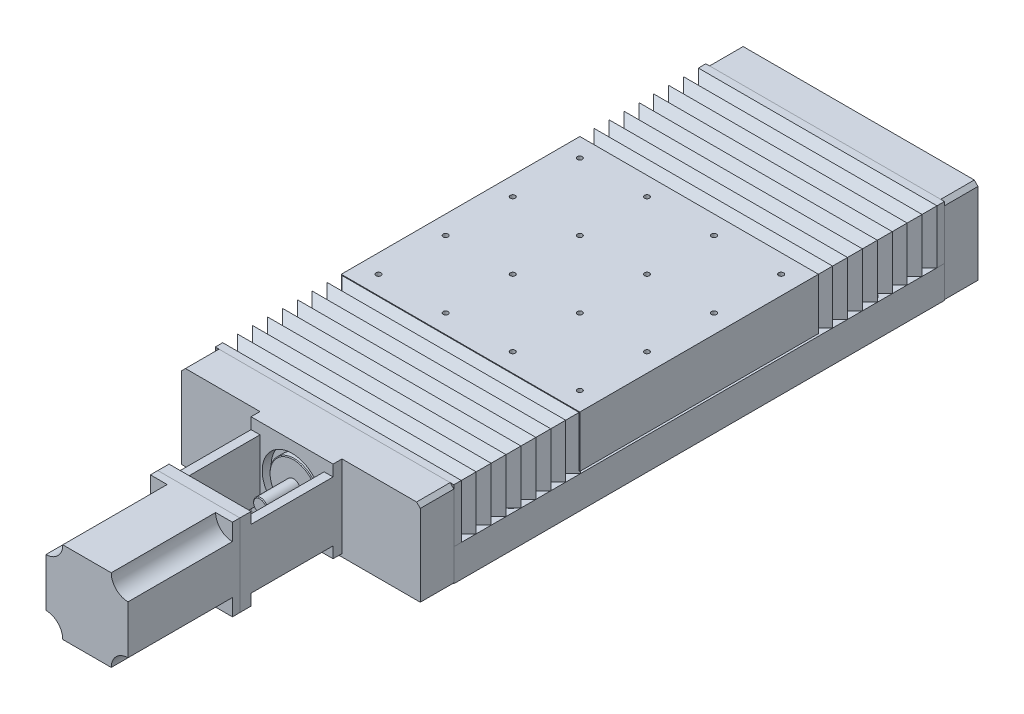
SolidWorks part; units mm, degrees
ref_plane "前视基准面" through (0, 0, 0) normal (0, 0, 1) x (1, 0, 0)
ref_plane "上视基准面" through (0, 0, 0) normal (0, 1, 0) x (1, 0, 0)
ref_plane "右视基准面" through (0, 0, 0) normal (1, 0, 0) x (0, 0, -1)
sketch "草图1" plane through (0, 0, 0) normal (0, 0, 1) x (1, 0, 0)
  line L0 (80, 0) -> (-80, 0)
  line L1 (-80, 0) -> (-80, 23)
  line L2 (-80, 23) -> (-101, 23)
  line L3 (-101, 23) -> (-101, 20)
  line L4 (-101, 20) -> (-129, 20)
  line L5 (-129, 20) -> (-129, 18)
  line L6 (-129, 18) -> (-160, 18)
  line L7 (-160, 18) -> (-160, -25)
  line L8 (-160, -25) -> (160, -25)
  line L9 (0, 0) -> (0, -25) construction
  line L10 (160, 18) -> (160, -25)
  line L11 (129, 18) -> (160, 18)
  line L12 (129, 20) -> (129, 18)
  line L13 (101, 20) -> (129, 20)
  line L14 (101, 23) -> (101, 20)
  line L15 (80, 23) -> (101, 23)
  line L16 (80, 0) -> (80, 23)
  dimension "D1" = 80
  dimension "D2" = 25
  dimension "D3" = 48
  dimension "D4" = 45
  dimension "D5" = 43
  dimension "D6" = 160
  dimension "D7" = 129
  dimension "D8" = 101
extrude "凸台-拉伸1" add sketch "草图1" along normal blind 658
sketch "草图2" plane through (0, 0, 658) normal (0, 0, 1) x (1, 0, 0)
  line L0 (-160, -25) -> (160, -25) construction
  line L1 (-90, -25) -> (90, -25)
  line L2 (-90, -25) -> (-90, -24)
  line L3 (-90, -24) -> (90, -24)
  line L4 (90, -25) -> (90, -24)
  line L5 (0, -24) -> (0, 0) construction
  dimension "D1" = 180
  dimension "D2" = 1
extrude "切除-拉伸1" cut sketch "草图2" against normal through all
sketch "草图3" plane through (0, 20, 0) normal (0, 1, 0) x (1, 0, 0)
  line L0 (0, 0) -> (0, -658) construction
  line L1 (-101, 0) -> (-129, 0)
  line L2 (-101, 0) -> (-101, -658)
  line L3 (-101, -658) -> (-129, -658)
  line L4 (-129, 0) -> (-129, -658)
  line L5 (80, -658) -> (-80, -658) construction
  line L6 (129, 0) -> (129, -658)
  line L7 (101, -658) -> (129, -658)
  line L8 (101, 0) -> (101, -658)
  line L9 (101, 0) -> (129, 0)
extrude "凸台-拉伸2" add sketch "草图3" along normal blind 42 separate body
ref_plane "基准面1" through (0, 0, 329) normal (0, 0, 1) x (1, 0, 0)
sketch "草图4" plane through (0, 0, 329) normal (0, 0, 1) x (1, 0, 0)
  line L0 (0, 0) -> (0, 62) construction
  line L1 (-101, 62) -> (101, 62) construction
  line L2 (-115, 62) -> (-85, 62)
  line L3 (-129, 62) -> (-101, 62) construction
  line L4 (-85, 62) -> (-85, 59)
  line L5 (-85, 59) -> (-45, 59)
  line L6 (-45, 59) -> (-45, 62)
  line L7 (-45, 62) -> (45, 62)
  line L8 (-115, 62) -> (-145, 62)
  line L9 (-145, 62) -> (-145, 59)
  line L10 (-145, 59) -> (-150, 59)
  line L11 (-150, 59) -> (-150, 21)
  line L12 (-150, 21) -> (-160, 21)
  line L13 (-160, 21) -> (-160, 90)
  line L14 (-160, 90) -> (160, 90)
  line L15 (0, 90) -> (0, 62) construction
  line L16 (160, 21) -> (160, 90)
  line L17 (150, 21) -> (160, 21)
  line L18 (150, 59) -> (150, 21)
  line L19 (145, 59) -> (150, 59)
  line L20 (145, 62) -> (145, 59)
  line L21 (115, 62) -> (145, 62)
  line L22 (45, 59) -> (45, 62)
  line L23 (85, 59) -> (45, 59)
  line L24 (85, 62) -> (85, 59)
  line L25 (115, 62) -> (85, 62)
  dimension "D1" = 30
  dimension "D2" = 28
  dimension "D3" = 160
  dimension "D4" = 10
  dimension "D5" = 69
  dimension "D6" = 60
  dimension "D7" = 31
  dimension "D8" = 31
  dimension "D9" = 45
extrude "凸台-拉伸3" add sketch "草图4" along normal mid plane 320
sketch "草图5" plane through (0, 0, 489) normal (0, 0, 1) x (1, 0, 0)
  line L0 (45, 62) -> (45, 59) construction
  line L1 (-45, 62) -> (45, 62)
  line L2 (-45, 62) -> (-45, 5)
  line L3 (-45, 5) -> (45, 5)
  line L4 (45, 62) -> (45, 5)
  line L5 (160, 90) -> (-160, 90) construction
  line L6 (0, 62) -> (0, 35) construction
  circle A0 centre (0, 35) radius 17.5
  dimension "D2" = 55
  dimension "D3" = 35
  dimension "D1" = 85
extrude "凸台-拉伸4" add sketch "草图5" against normal blind 150
chamfer "倒角1" distance 10 angle 45 2 edges at (45, 5, 414) (-45, 5, 414)
sketch "草图6" plane through (0, 0, 489) normal (0, 0, 1) x (1, 0, 0)
  circle A0 centre (0, 35) radius 25
  dimension "D1" = 50
extrude "切除-拉伸2" cut sketch "草图6" against normal blind 90
sketch "草图7" plane through (0, 0, 489) normal (0, 0, 1) x (1, 0, 0)
  line L1 (-45, 59) -> (47.6912, 59)
  line L2 (-45, 59) -> (-45, 3.5297)
  line L3 (-45, 3.5297) -> (47.6912, 3.5297)
  line L4 (47.6912, 59) -> (47.6912, 3.5297)
extrude "切除-拉伸3" cut sketch "草图7" against normal blind 14
sketch "草图8" plane through (0, 0, 658) normal (0, 0, 1) x (1, 0, 0)
  line L0 (160, -25) -> (160, 18) construction
  line L1 (-160, 90) -> (160, 90)
  line L2 (-160, 90) -> (-160, -24)
  line L3 (-160, -24) -> (160, -24)
  line L4 (160, 90) -> (160, -24)
  line L5 (90, -24) -> (-90, -24) construction
extrude "凸台-拉伸5" add sketch "草图8" along normal blind 45 separate body
sketch "草图9" plane through (0, 0, 0) normal (0, 0, -1) x (-1, 0, 0)
  line L0 (160, 18) -> (160, -25) construction
  line L1 (-160, 90) -> (160, 90)
  line L2 (-160, 90) -> (-160, -24)
  line L3 (-160, -24) -> (160, -24)
  line L4 (160, 90) -> (160, -24)
  line L5 (-90, -24) -> (90, -24) construction
extrude "凸台-拉伸6" add sketch "草图9" along normal blind 45 separate body
sketch "草图10" plane through (0, 0, 0) normal (0, 0, 1) x (1, 0, 0)
  line L0 (0, 90) -> (0, 35) construction
  line L1 (-160, 90) -> (160, 90) construction
  circle A0 centre (0, 35) radius 16
  dimension "D2" = 32
  dimension "D1" = 55
extrude "凸台-拉伸7" add sketch "草图10" along normal up to surface (703 mm away) separate body
sketch "草图11" plane through (0, 0, 703) normal (0, 0, 1) x (1, 0, 0)
  circle A0 centre (0, 35) radius 9.5
  dimension "D1" = 19
extrude "凸台-拉伸8" add sketch "草图11" along normal blind 55
sketch "草图12" plane through (0, 0, 703) normal (0, 0, 1) x (1, 0, 0)
  circle A0 centre (0, 35) radius 32.5
  dimension "D1" = 65
extrude "凸台-拉伸9" add sketch "草图12" along normal blind 10
sketch "草图13" plane through (0, 18, 0) normal (0, 1, 0) x (1, 0, 0)
  line L0 (-147.5, 0) -> (-147.5, -658) construction
  line L1 (-160, 0) -> (160, 0) construction
  line L2 (160, -658) -> (-160, -658) construction
  line L3 (0, 0) -> (0, -658) construction
  line L4 (80, -658) -> (-80, -658) construction
  line L5 (-129, 0) -> (-160, 0) construction
  point P11 (-147.5, -89)
  dimension "D1" = 147.5
  dimension "D2" = 89
hole_wizard "打孔尺寸根据内六角圆柱头螺钉的类型1" positions "3D草图1" profile "草图14" counterbore size "M10" standard "GB"
sketch3d "3D草图1"
  point P0 (-147.5, 18, 89)
sketch "草图14" plane through (-147.5, 18, 89) normal (1, 0, 0) x (0, 0, 1)
  line L0 (0, 0) -> (0, 43)
  line L1 (0, 43) -> (5.5, 43)
  line L3 (5.5, 43) -> (5.5, 11)
  line L4 (5.5, 11) -> (9, 11)
  line L5 (9, 11) -> (9, 0)
  line L7 (9, 0) -> (0, 0)
  line L11 (0, -6.35) -> (0, 107.95) construction
  dimension "通孔孔直径" = 11
  dimension "通孔孔深度" = 43
  dimension "柱形沉头孔直径" = 18
  dimension "柱形沉头孔深度" = 11
pattern_linear "阵列(线性)1" count 4 spacing 160 along (0, 0, 1) of "打孔尺寸根据内六角圆柱头螺钉的类型1"
pattern_linear "阵列(线性)2" count 2 spacing 295 along (1, 0, 0) of "打孔尺寸根据内六角圆柱头螺钉的类型1", "阵列(线性)1"
sketch "草图15" plane through (0, 18, 0) normal (0, 1, 0) x (1, 0, 0)
  line L0 (160, -658) -> (160, -648)
  line L1 (160, -658) -> (160, 0) construction
  line L2 (160, -648) -> (150, -638)
  line L3 (150, -638) -> (160, -628)
  line L4 (150, -638) -> (160, -638) construction
  line L5 (160, -628) -> (150, -618)
  line L6 (150, -618) -> (160, -608)
  line L7 (160, -608) -> (150, -598)
  line L8 (150, -598) -> (160, -588)
  line L9 (160, -588) -> (150, -578)
  line L10 (150, -578) -> (160, -568)
  line L11 (160, -568) -> (150, -558)
  line L12 (150, -558) -> (160, -548)
  line L13 (160, -548) -> (150, -538)
  line L14 (150, -538) -> (160, -528)
  line L15 (160, -528) -> (150, -518)
  line L16 (150, -518) -> (160, -508)
  line L17 (160, -508) -> (150, -498)
  line L18 (150, -498) -> (160, -488)
  line L31 (160, -528) -> (150, -518)
  line L32 (150, -518) -> (160, -508)
  line L33 (160, -508) -> (150, -498)
  line L34 (150, -498) -> (160, -488)
  line L35 (160, -488) -> (150, -478)
  line L36 (150, -478) -> (160, -468)
  line L43 (160, -468) -> (150, -458)
  line L44 (150, -458) -> (160, -448)
  line L45 (160, -448) -> (150, -438)
  line L46 (150, -438) -> (160, -428)
  line L49 (160, -428) -> (150, -418)
  line L50 (150, -418) -> (160, -408)
  line L51 (150, -618) -> (160, -608)
  line L52 (160, -608) -> (150, -598)
  line L53 (150, -598) -> (160, -588)
  line L54 (160, -588) -> (150, -578)
  line L55 (150, -578) -> (160, -568)
  line L56 (160, -568) -> (150, -558)
  line L57 (150, -558) -> (160, -548)
  line L58 (160, -548) -> (150, -538)
  line L59 (150, -538) -> (160, -528)
  line L60 (160, -628) -> (150, -618)
  dimension "D1" = 10
  dimension "D2" = 20
  dimension "D3" = 45
  dimension "D4" = 45
  dimension "D5" = 6
sketch "草图16" plane through (0, 0, 658) normal (0, 0, -1) x (-1, 0, 0)
  line L0 (-160, 18) -> (-160, 90)
  line L1 (-160, 90) -> (160, 90)
  line L2 (160, 90) -> (160, 18)
  line L3 (0, 90) -> (0, 0) construction
surface "曲面-扫描1"
mirror "镜向3" about plane through (0, 0, 329) normal (0, 0, 1)
sketch "草图17" plane through (0, 0, 703) normal (0, 0, 1) x (1, 0, 0)
  line L0 (160, 90) -> (-160, 90) construction
  line L1 (-280, 87) -> (80, 87)
  line L2 (-280, 87) -> (-280, -23)
  line L3 (-280, -23) -> (80, -23)
  line L4 (80, 87) -> (80, -23)
  line L5 (-160, 90) -> (-160, -24) construction
  circle A0 centre (0, 35) radius 9.5 construction
  circle A1 centre (0, 35) radius 40
  dimension "D4" = 80
  dimension "D1" = 110
  dimension "D2" = 120
  dimension "D3" = 80
  dimension "D5" = 3
extrude "凸台-拉伸10" [suppressed] add sketch "草图17" along normal blind 15 separate body
sketch "草图18" [suppressed] plane through (0, 0, 718) normal (0, 0, 1) x (1, 0, 0)
  line L0 (0, 35) -> (-225, 32) construction
  line L1 (-280, 32) -> (-225, 32) construction
  line L2 (-280, 87) -> (-280, -23) construction
  circle A0 centre (-225, 32) radius 30
  dimension "D2" = 60
  dimension "D1" = 55
extrude "切除-拉伸4" [suppressed] cut sketch "草图18" against normal through all
sketch "草图19" [suppressed] plane through (0, 0, 703) normal (0, 0, -1) x (-1, 0, 0)
  line L0 (225, 87) -> (225, 32) construction
  line L1 (170, 87) -> (280, 87)
  line L2 (170, 87) -> (170, -23)
  line L3 (170, -23) -> (280, -23)
  line L4 (280, 87) -> (280, -23)
  line L5 (225, 32) -> (280, 32) construction
  dimension "D1" = 110
  dimension "D2" = 110
extrude "凸台-拉伸11" [suppressed] add sketch "草图19" along normal blind 150 separate body
sketch "草图20" [suppressed] plane through (0, 0, 703) normal (0, 0, 1) x (1, 0, 0)
  circle A0 centre (-225, 32) radius 9.5
  dimension "D1" = 19
extrude "凸台-拉伸12" [suppressed] add sketch "草图20" along normal blind 54 separate body
sketch "草图21" [suppressed] plane through (0, 0, 553) normal (0, 0, -1) x (-1, 0, 0)
  circle A0 centre (280, 87) radius 25
  dimension "D1" = 50
extrude "切除-拉伸5" [suppressed] cut sketch "草图21" against normal blind 138
pattern_circular "阵列(圆周)1" [suppressed] count 4 over 360
fillet "圆角1" [suppressed] radius 5
fillet "圆角2" [suppressed] radius 5
fillet "圆角3" [suppressed] radius 5
sketch "草图22" [suppressed] plane through (0, 0, 758) normal (0, 0, 1) x (1, 0, 0)
  circle A0 centre (0, 35) radius 34.865
  circle A1 centre (-225, 32) radius 34.865
  dimension "D1" = 69.73
  dimension "D2" = 69.73
extrude "凸台-拉伸13" [suppressed] add sketch "草图22" against normal blind 26 separate body
sketch "草图23" [suppressed] plane through (0, 0, 758) normal (0, 0, 1) x (1, 0, 0)
  circle A0 centre (0, 35) radius 39
  circle A1 centre (-225, 32) radius 39
  dimension "D1" = 78
  dimension "D2" = 78
extrude "凸台-拉伸14" [suppressed] add sketch "草图23" along normal blind 2.5
sketch "草图24" [suppressed] plane through (0, 0, 732) normal (0, 0, -1) x (-1, 0, 0)
  circle A0 centre (0, 35) radius 39
  circle A1 centre (225, 32) radius 39
extrude "凸台-拉伸15" [suppressed] add sketch "草图24" along normal blind 2.5
sketch "草图25" [suppressed] plane through (0, 0, 703) normal (0, 0, 1) x (1, 0, 0)
  line L0 (80, 87) -> (-280, 87) construction
  line L1 (77.5, 87.5) -> (-277.5, 87.5)
  line L2 (80.5, 84.5) -> (80.5, -20.5)
  line L3 (77.5, -23.5) -> (-277.5, -23.5)
  line L4 (-280.5, 84.5) -> (-280.5, -20.5)
  line L5 (-280, 87) -> (-280, -23) construction
  line L6 (-280, -23) -> (80, -23) construction
  line L7 (80, -23) -> (80, 87) construction
  line L8 (77.5, 88.5) -> (-277.5, 88.5)
  line L9 (-281.5, 84.5) -> (-281.5, -20.5)
  line L10 (77.5, -24.5) -> (-277.5, -24.5)
  line L11 (81.5, 84.5) -> (81.5, -20.5)
  arc A0 (80.5, 84.5) -> (77.5, 87.5) centre (77.5, 84.5) ccw
  arc A1 (77.5, -23.5) -> (80.5, -20.5) centre (77.5, -20.5) ccw
  arc A2 (-277.5, -23.5) -> (-280.5, -20.5) centre (-277.5, -20.5) cw
  arc A3 (-280.5, 84.5) -> (-277.5, 87.5) centre (-277.5, 84.5) cw
  arc A4 (-281.5, 84.5) -> (-277.5, 88.5) centre (-277.5, 84.5) cw
  arc A5 (-277.5, -24.5) -> (-281.5, -20.5) centre (-277.5, -20.5) cw
  arc A6 (77.5, -24.5) -> (81.5, -20.5) centre (77.5, -20.5) ccw
  arc A7 (81.5, 84.5) -> (77.5, 88.5) centre (77.5, 84.5) ccw
  dimension "D5" = 3
  dimension "D1" = 0.5
  dimension "D2" = 0.5
  dimension "D3" = 0.5
  dimension "D4" = 0.5
  dimension "D6" = 1
extrude "凸台-拉伸16" [suppressed] add sketch "草图25" along normal blind 70 separate body
sketch "草图26" [suppressed] plane through (0, 0, 773) normal (0, 0, 1) x (1, 0, 0)
  line L0 (-281.5, 84.5) -> (-281.5, -20.5)
  line L1 (-277.5, -24.5) -> (77.5, -24.5) construction
  line L2 (-277.5, 88.5) -> (77.5, 88.5)
  line L3 (81.5, 84.5) -> (81.5, -20.5)
  line L4 (77.5, -24.5) -> (-277.5, -24.5)
  arc A0 (-281.5, -20.5) -> (-277.5, -24.5) centre (-277.5, -20.5) ccw
  arc A1 (77.5, -24.5) -> (81.5, -20.5) centre (77.5, -20.5) ccw
  arc A2 (77.5, -24.5) -> (81.5, -20.5) centre (77.5, -20.5) ccw construction
  arc A3 (81.5, 84.5) -> (77.5, 88.5) centre (77.5, 84.5) ccw
  arc A4 (81.5, 84.5) -> (77.5, 88.5) centre (77.5, 84.5) ccw construction
  arc A5 (-277.5, 88.5) -> (-281.5, 84.5) centre (-277.5, 84.5) ccw
extrude "凸台-拉伸17" [suppressed] add sketch "草图26" along normal blind 1 separate body
sketch "草图27" plane through (0, 0, 703) normal (0, 0, 1) x (1, 0, 0)
  line L0 (0, 35) -> (0, 90) construction
  line L1 (-55, 90) -> (55, 90)
  line L2 (-55, 90) -> (-55, -20)
  line L3 (-55, -20) -> (55, -20)
  line L4 (55, 90) -> (55, -20)
  line L5 (55, 35) -> (0, 35) construction
  circle A0 centre (0, 35) radius 40
  dimension "D3" = 80
  dimension "D1" = 110
  dimension "D2" = 110
extrude "凸台-拉伸18" add sketch "草图27" along normal blind 12 separate body
sketch "草图28" plane through (0, 0, 715) normal (0, 0, 1) x (1, 0, 0)
  line L0 (-55, -20) -> (55, -20) construction
  line L1 (-55, 90) -> (-43, 90)
  line L2 (-55, 90) -> (-55, -20)
  line L3 (-55, -20) -> (-43, -20)
  line L4 (-43, 90) -> (-43, -20)
  line L5 (0, 35) -> (0, 90) construction
  line L6 (55, 90) -> (-55, 90) construction
  line L7 (43, 90) -> (43, -20)
  line L8 (55, -20) -> (43, -20)
  line L9 (55, 90) -> (55, -20)
  line L10 (55, 90) -> (43, 90)
  dimension "D1" = 12
extrude "凸台-拉伸19" add sketch "草图28" along normal blind 110
sketch "草图29" plane through (0, 0, 825) normal (0, 0, 1) x (1, 0, 0)
  line L0 (0, 35) -> (-55, 35) construction
  line L1 (-55, 90) -> (55, 90)
  line L2 (-55, 90) -> (-55, -20)
  line L3 (-55, -20) -> (55, -20)
  line L4 (55, 90) -> (55, -20)
  line L6 (-55, 90) -> (-55, -20) construction
  line L7 (55, -20) -> (55, 90) construction
  circle A0 centre (0, 35) radius 40
  dimension "D1" = 110
extrude "凸台-拉伸20" add sketch "草图29" along normal blind 15
sketch "草图30" plane through (0, 0, 840) normal (0, 0, 1) x (1, 0, 0)
  line L0 (55, -20) -> (55, 90) construction
  line L1 (-55, 90) -> (55, 90)
  line L2 (-55, 90) -> (-55, -20)
  line L3 (-55, -20) -> (55, -20)
  line L4 (55, 90) -> (55, -20)
extrude "凸台-拉伸21" add sketch "草图30" along normal blind 150 separate body
sketch "草图31" plane through (0, 0, 840) normal (0, 0, -1) x (-1, 0, 0)
  circle A0 centre (0, 31.616) radius 9.5
  dimension "D1" = 19
extrude "凸台-拉伸22" add sketch "草图31" along normal blind 56 separate body
sketch "草图32" plane through (0, 0, 990) normal (0, 0, 1) x (1, 0, 0)
  line L0 (0, 90) -> (0, 35) construction
  line L1 (55, 90) -> (-55, 90) construction
  line L2 (0, 35) -> (55, 35) construction
  line L3 (55, -20) -> (55, 90) construction
  circle A0 centre (-55, 90) radius 22.5
  circle A1 centre (55, 90) radius 22.5
  circle A2 centre (-55, -20) radius 22.5
  circle A3 centre (55, -20) radius 22.5
  dimension "D1" = 45
extrude "切除-拉伸6" cut sketch "草图32" against normal blind 140
sketch "草图33" plane through (-55, 0, 0) normal (-1, 0, 0) x (0, 0, 1)
  line L0 (840, 90) -> (840, -20) construction
  line L1 (715, 90) -> (825, 90)
  line L2 (715, 90) -> (715, 75)
  line L3 (715, 75) -> (825, 75)
  line L4 (825, 90) -> (825, 75)
  line L5 (703, 35) -> (840, 35) construction
  line L7 (825, -20) -> (825, -5)
  line L8 (715, -5) -> (825, -5)
  line L9 (715, -20) -> (715, -5)
  line L10 (715, -20) -> (825, -20)
  line L11 (840, 90) -> (840, -20) construction
  line L12 (840, 90) -> (703, 90) construction
  line L13 (703, 90) -> (703, -20) construction
  dimension "D1" = 15
  dimension "D2" = 15
  dimension "D3" = 12
extrude "切除-拉伸8" cut sketch "草图33" against normal through all
sketch "草图34" plane through (0, 90, 0) normal (0, 1, 0) x (1, 0, 0)
  line L0 (-135, -194) -> (-45, -194) construction
  line L1 (-45, -194) -> (-45, -284) construction
  line L2 (-45, -284) -> (-135, -284) construction
  line L3 (-135, -284) -> (-135, -194) construction
  line L4 (0, -169) -> (0, -489) construction
  line L5 (160, -169) -> (-160, -169) construction
  line L6 (160, -489) -> (-160, -489) construction
  line L7 (-160, -329) -> (160, -329) construction
  line L8 (-160, -489) -> (-160, -169) construction
  line L9 (160, -489) -> (160, -169) construction
  line L10 (135, -284) -> (135, -194) construction
  line L11 (45, -284) -> (135, -284) construction
  line L12 (45, -194) -> (45, -284) construction
  line L13 (135, -194) -> (45, -194) construction
  line L14 (135, -464) -> (45, -464) construction
  line L15 (45, -464) -> (45, -374) construction
  line L16 (45, -374) -> (135, -374) construction
  line L17 (135, -374) -> (135, -464) construction
  line L18 (-135, -374) -> (-135, -464) construction
  line L19 (-45, -374) -> (-135, -374) construction
  line L20 (-45, -464) -> (-45, -374) construction
  line L21 (-135, -464) -> (-45, -464) construction
  dimension "D1" = 90
  dimension "D2" = 45
  dimension "D3" = 45
  dimension "D4" = 90
hole_wizard "M8 螺纹孔1" positions "3D草图2" profile "草图35" tap size "M8" standard "ISO"
sketch3d "3D草图2"
  point P0 (-135, 90, 194)
  point P3 (-135, 90, 284)
  point P6 (-45, 90, 284)
  point P9 (-45, 90, 194)
  point P12 (45, 90, 194)
  point P15 (45, 90, 284)
  point P18 (135, 90, 284)
  point P21 (135, 90, 194)
  point P24 (135, 90, 374)
  point P27 (135, 90, 464)
  point P30 (45, 90, 464)
  point P33 (45, 90, 374)
  point P36 (-45, 90, 374)
  point P39 (-45, 90, 464)
  point P42 (-135, 90, 374)
  point P45 (-135, 90, 464)
sketch "草图35" plane through (-135, 90, 194) normal (1, 0, 0) x (0, 0, 1)
  line L0 (0, 0) -> (0, 21.7929)
  line L1 (0, 21.7929) -> (3.4, 19.75)
  line L2 (3.4, 19.75) -> (3.4, 0)
  line L5 (3.4, 0) -> (0, 0)
  line L10 (0, 21.7929) -> (-3.4, 19.75) construction
  line L11 (0, -6.35) -> (0, 107.95) construction
  dimension "螺纹孔钻头直径" = 6.8
  dimension "螺纹孔钻头深度" = 19.75
  dimension "导头角度" = 118
chamfer "倒角2" distance 5 angle 45 2 edges at (-160, 90, 680.5) (160, 90, 680.5)
chamfer "倒角3" distance 5 angle 45 2 edges at (-160, 90, -22.5) (160, 90, -22.5)
sketch "草图36" plane through (0, 0, 703) normal (0, 0, 1) x (1, 0, 0)
  line L0 (0, 35) -> (0, 5) construction
  line L1 (-35, 65) -> (35, 65) construction
  line L2 (-35, 65) -> (-35, 5) construction
  line L3 (-35, 5) -> (35, 5) construction
  line L4 (35, 65) -> (35, 5) construction
  line L5 (0, 35) -> (35, 35) construction
  dimension "D1" = 70
  dimension "D2" = 60
hole_wizard "M8 螺纹孔2" positions "3D草图3" profile "草图37" tap size "M8" standard "GB"
sketch3d "3D草图3"
  point P0 (-35, 65, 703)
  point P3 (-35, 5, 703)
  point P6 (35, 5, 703)
  point P9 (35, 65, 703)
sketch "草图37" plane through (-35, 65, 703) normal (1, 0, 0) x (0, -1, 0)
  line L0 (0, 0) -> (0, 21.7929)
  line L1 (0, 21.7929) -> (3.4, 19.75)
  line L2 (3.4, 19.75) -> (3.4, 0)
  line L5 (3.4, 0) -> (0, 0)
  line L10 (0, 21.7929) -> (-3.4, 19.75) construction
  line L11 (0, -6.35) -> (0, 107.95) construction
  dimension "螺纹孔钻头直径" = 6.8
  dimension "螺纹孔钻头深度" = 19.75
  dimension "导头角度" = 118
chamfer "倒角4" distance 1 angle 45 2 edges at (9.5, 35, 758) (32.5, 35, 713)
